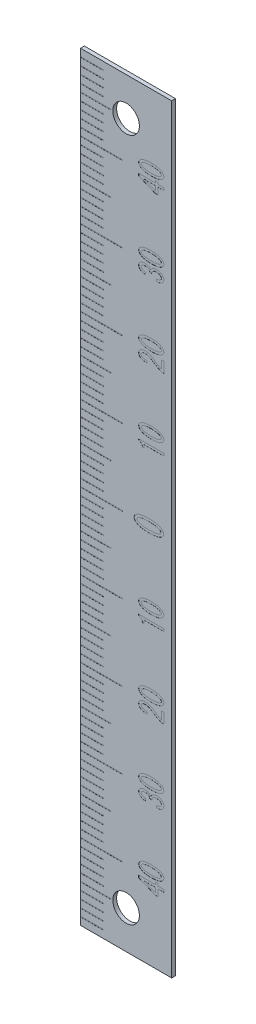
SolidWorks part; units mm, degrees
ref_plane "Front" through (0, 0, 0) normal (0, 0, 1) x (1, 0, 0)
ref_plane "Top" through (0, 0, 0) normal (0, 1, 0) x (1, 0, 0)
ref_plane "Right" through (0, 0, 0) normal (1, 0, 0) x (0, 0, -1)
sketch "Sketch1" plane through (0, 0, 0) normal (0, 0, 1) x (1, 0, 0)
  line L1 (0, 0) -> (0, 100)
  line L2 (0, 0) -> (12, 0)
  line L3 (12, 0) -> (12, 100)
  line L4 (0, 100) -> (12, 100)
  dimension "D1" = 100
  dimension "D2" = 12
extrude "Extrude1" add sketch "Sketch1" along normal blind 0.5
sketch "Sketch2" plane through (0, 0, 0.5) normal (0, 0, 1) x (1, 0, 0)
  line L0 (0, 100) -> (0, 0) construction
  line L1 (0, 0) -> (12, 0) construction
  line L2 (12, 100) -> (0, 100) construction
  circle A0 centre (6, 5) radius 1.75
  circle A1 centre (6, 95) radius 1.75
  dimension "D1" = 6
  dimension "D2" = 6
  dimension "D3" = 5
  dimension "D4" = 5
  dimension "D5" = 3.5
  dimension "D6" = 3.5
extrude "Extrude2" cut sketch "Sketch2" against normal through all
sketch "Sketch3" plane through (0, 0, 0.5) normal (0, 0, 1) x (1, 0, 0)
  line L0 (12, 100) -> (0, 100) construction
  line L1 (7.5, 88.25) -> (11, 88.25) construction
  line L2 (7.5, 88.25) -> (7.5, 91.75) construction
  line L3 (7.5, 91.75) -> (11, 91.75) construction
  line L4 (11, 88.25) -> (11, 91.75) construction
  line L6 (11, 78.25) -> (11, 81.75) construction
  line L7 (11, 68.25) -> (11, 71.75) construction
  line L8 (11, 58.25) -> (11, 61.75) construction
  line L9 (11, 49.125) -> (11, 52.625) construction
  line L10 (11, 38.25) -> (11, 41.75) construction
  line L11 (11, 28.25) -> (11, 31.75) construction
  line L12 (11, 18.25) -> (11, 21.75) construction
  line L13 (11, 8.25) -> (11, 11.75) construction
  line L14 (8.2751, 50) -> (-8.2751, 50) construction
  line L15 (8.2751, 40) -> (-8.2751, 40) construction
  line L16 (12, 0) -> (12, 100) construction
  line L17 (8.2751, 30) -> (-8.2751, 30) construction
  line L18 (8.2751, 20) -> (-8.2751, 20) construction
  line L19 (8.2751, 10) -> (-8.2751, 10) construction
  line L20 (8.2751, 60) -> (-8.2751, 60) construction
  line L21 (8.2751, 70) -> (-8.2751, 70) construction
  line L22 (8.2751, 80) -> (-8.2751, 80) construction
  line L23 (8.2751, 90) -> (-8.2751, 90) construction
  text T0 "40" font "ＭＳ ゴシック" height in points 11
  text T1 "30" font "ＭＳ ゴシック" height in points 11
  text T2 "20" font "ＭＳ ゴシック" height in points 11
  text T3 "10" font "ＭＳ ゴシック" height in points 11
  text T4 "0" font "ＭＳ ゴシック" height in points 13
  text T5 "10  " font "ＭＳ ゴシック" height in points 11
  text T6 "20" font "ＭＳ ゴシック" height in points 11
  text T7 "30" font "ＭＳ ゴシック" height in points 11
  text T8 "40" font "ＭＳ ゴシック" height in points 11
  point P4 (11, 90)
  point P36 (0, 50)
  dimension "D1" = 3.5
  dimension "D2" = 10
  dimension "D3" = 1
  dimension "D4" = 3.5
  dimension "D7" = 5
  dimension "D9" = 0.875
  dimension "D6" = 1
  dimension "D5" = 4
  dimension "D8" = 5
extrude "Extrude3" cut sketch "Sketch3" against normal blind 0.01
sketch "Sketch4" plane through (0, 0, 0.5) normal (0, 0, 1) x (1, 0, 0)
  line L5 (12, 100) -> (0, 100) construction
  line L406 (6, 100) -> (6, 0) construction
  line L407 (0, 0) -> (12, 0) construction
  line L408 (3, 1.05) -> (3, 0.95)
  line L409 (0, 0.95) -> (3, 0.95)
  line L410 (0, 1.05) -> (3, 1.05)
  line L411 (0, 1.05) -> (0, 0.95)
  line L412 (3, 2.05) -> (3, 1.95)
  line L413 (0, 1.95) -> (3, 1.95)
  line L414 (0, 2.05) -> (3, 2.05)
  line L415 (0, 2.05) -> (0, 1.95)
  line L416 (3, 3.05) -> (3, 2.95)
  line L417 (0, 2.95) -> (3, 2.95)
  line L418 (0, 3.05) -> (3, 3.05)
  line L419 (0, 3.05) -> (0, 2.95)
  line L420 (3, 4.05) -> (3, 3.95)
  line L421 (0, 3.95) -> (3, 3.95)
  line L422 (0, 4.05) -> (3, 4.05)
  line L423 (0, 4.05) -> (0, 3.95)
  line L424 (3, 6.05) -> (3, 5.95)
  line L425 (0, 5.95) -> (3, 5.95)
  line L426 (0, 6.05) -> (3, 6.05)
  line L427 (0, 6.05) -> (0, 5.95)
  line L428 (3, 7.05) -> (3, 6.95)
  line L429 (0, 6.95) -> (3, 6.95)
  line L430 (0, 7.05) -> (3, 7.05)
  line L431 (0, 7.05) -> (0, 6.95)
  line L432 (3, 8.05) -> (3, 7.95)
  line L433 (0, 7.95) -> (3, 7.95)
  line L434 (0, 8.05) -> (3, 8.05)
  line L435 (3, 9.05) -> (3, 8.95)
  line L436 (0, 8.95) -> (3, 8.95)
  line L437 (0, 9.05) -> (0, 8.95)
  line L438 (0, 9.05) -> (3, 9.05)
  line L439 (4, 4.95) -> (4, 5.05)
  line L440 (0, 5.05) -> (4, 5.05)
  line L441 (0, 4.95) -> (0, 5.05)
  line L442 (0, 4.95) -> (4, 4.95)
  line L443 (0, 8.05) -> (0, 7.95)
  line L444 (0, 9.95) -> (0, 10.05)
  line L445 (5.5, 9.95) -> (0, 9.95)
  line L446 (5.5, 10.05) -> (5.5, 9.95)
  line L447 (0, 10.05) -> (5.5, 10.05)
  line L448 (3, 11.05) -> (3, 10.95)
  line L449 (0, 10.95) -> (3, 10.95)
  line L450 (0, 11.05) -> (3, 11.05)
  line L451 (0, 11.05) -> (0, 10.95)
  line L452 (3, 12.05) -> (3, 11.95)
  line L453 (0, 11.95) -> (3, 11.95)
  line L454 (0, 12.05) -> (3, 12.05)
  line L455 (0, 12.05) -> (0, 11.95)
  line L456 (3, 13.05) -> (3, 12.95)
  line L457 (0, 12.95) -> (3, 12.95)
  line L458 (0, 13.05) -> (3, 13.05)
  line L459 (0, 13.05) -> (0, 12.95)
  line L460 (3, 14.05) -> (3, 13.95)
  line L461 (0, 13.95) -> (3, 13.95)
  line L462 (0, 14.05) -> (3, 14.05)
  line L463 (0, 14.05) -> (0, 13.95)
  line L464 (3, 16.05) -> (3, 15.95)
  line L465 (0, 15.95) -> (3, 15.95)
  line L466 (0, 16.05) -> (3, 16.05)
  line L467 (0, 16.05) -> (0, 15.95)
  line L468 (3, 17.05) -> (3, 16.95)
  line L469 (0, 16.95) -> (3, 16.95)
  line L470 (0, 17.05) -> (3, 17.05)
  line L471 (0, 17.05) -> (0, 16.95)
  line L472 (3, 18.05) -> (3, 17.95)
  line L473 (0, 17.95) -> (3, 17.95)
  line L474 (0, 18.05) -> (3, 18.05)
  line L475 (3, 19.05) -> (3, 18.95)
  line L476 (0, 18.95) -> (3, 18.95)
  line L477 (0, 19.05) -> (0, 18.95)
  line L478 (0, 19.05) -> (3, 19.05)
  line L479 (4, 14.95) -> (4, 15.05)
  line L480 (0, 15.05) -> (4, 15.05)
  line L481 (0, 14.95) -> (0, 15.05)
  line L482 (0, 14.95) -> (4, 14.95)
  line L483 (0, 18.05) -> (0, 17.95)
  line L484 (0, 19.95) -> (0, 20.05)
  line L485 (5.5, 19.95) -> (0, 19.95)
  line L486 (5.5, 20.05) -> (5.5, 19.95)
  line L487 (0, 20.05) -> (5.5, 20.05)
  line L488 (3, 21.05) -> (3, 20.95)
  line L489 (0, 20.95) -> (3, 20.95)
  line L490 (0, 21.05) -> (3, 21.05)
  line L491 (0, 21.05) -> (0, 20.95)
  line L492 (3, 22.05) -> (3, 21.95)
  line L493 (0, 21.95) -> (3, 21.95)
  line L494 (0, 22.05) -> (3, 22.05)
  line L495 (0, 22.05) -> (0, 21.95)
  line L496 (3, 23.05) -> (3, 22.95)
  line L497 (0, 22.95) -> (3, 22.95)
  line L498 (0, 23.05) -> (3, 23.05)
  line L499 (0, 23.05) -> (0, 22.95)
  line L500 (3, 24.05) -> (3, 23.95)
  line L501 (0, 23.95) -> (3, 23.95)
  line L502 (0, 24.05) -> (3, 24.05)
  line L503 (0, 24.05) -> (0, 23.95)
  line L504 (3, 26.05) -> (3, 25.95)
  line L505 (0, 25.95) -> (3, 25.95)
  line L506 (0, 26.05) -> (3, 26.05)
  line L507 (0, 26.05) -> (0, 25.95)
  line L508 (3, 27.05) -> (3, 26.95)
  line L509 (0, 26.95) -> (3, 26.95)
  line L510 (0, 27.05) -> (3, 27.05)
  line L511 (0, 27.05) -> (0, 26.95)
  line L512 (3, 28.05) -> (3, 27.95)
  line L513 (0, 27.95) -> (3, 27.95)
  line L514 (0, 28.05) -> (3, 28.05)
  line L515 (3, 29.05) -> (3, 28.95)
  line L516 (0, 28.95) -> (3, 28.95)
  line L517 (0, 29.05) -> (0, 28.95)
  line L518 (0, 29.05) -> (3, 29.05)
  line L519 (4, 24.95) -> (4, 25.05)
  line L520 (0, 25.05) -> (4, 25.05)
  line L521 (0, 24.95) -> (0, 25.05)
  line L522 (0, 24.95) -> (4, 24.95)
  line L523 (0, 28.05) -> (0, 27.95)
  line L524 (0, 29.95) -> (0, 30.05)
  line L525 (5.5, 29.95) -> (0, 29.95)
  line L526 (5.5, 30.05) -> (5.5, 29.95)
  line L527 (0, 30.05) -> (5.5, 30.05)
  line L528 (3, 31.05) -> (3, 30.95)
  line L529 (0, 30.95) -> (3, 30.95)
  line L530 (0, 31.05) -> (3, 31.05)
  line L531 (0, 31.05) -> (0, 30.95)
  line L532 (3, 32.05) -> (3, 31.95)
  line L533 (0, 31.95) -> (3, 31.95)
  line L534 (0, 32.05) -> (3, 32.05)
  line L535 (0, 32.05) -> (0, 31.95)
  line L536 (3, 33.05) -> (3, 32.95)
  line L537 (0, 32.95) -> (3, 32.95)
  line L538 (0, 33.05) -> (3, 33.05)
  line L539 (0, 33.05) -> (0, 32.95)
  line L540 (3, 34.05) -> (3, 33.95)
  line L541 (0, 33.95) -> (3, 33.95)
  line L542 (0, 34.05) -> (3, 34.05)
  line L543 (0, 34.05) -> (0, 33.95)
  line L544 (3, 36.05) -> (3, 35.95)
  line L545 (0, 35.95) -> (3, 35.95)
  line L546 (0, 36.05) -> (3, 36.05)
  line L547 (0, 36.05) -> (0, 35.95)
  line L548 (3, 37.05) -> (3, 36.95)
  line L549 (0, 36.95) -> (3, 36.95)
  line L550 (0, 37.05) -> (3, 37.05)
  line L551 (0, 37.05) -> (0, 36.95)
  line L552 (3, 38.05) -> (3, 37.95)
  line L553 (0, 37.95) -> (3, 37.95)
  line L554 (0, 38.05) -> (3, 38.05)
  line L555 (3, 39.05) -> (3, 38.95)
  line L556 (0, 38.95) -> (3, 38.95)
  line L557 (0, 39.05) -> (0, 38.95)
  line L558 (0, 39.05) -> (3, 39.05)
  line L559 (4, 34.95) -> (4, 35.05)
  line L560 (0, 35.05) -> (4, 35.05)
  line L561 (0, 34.95) -> (0, 35.05)
  line L562 (0, 34.95) -> (4, 34.95)
  line L563 (0, 38.05) -> (0, 37.95)
  line L564 (0, 39.95) -> (0, 40.05)
  line L565 (5.5, 39.95) -> (0, 39.95)
  line L566 (5.5, 40.05) -> (5.5, 39.95)
  line L567 (0, 40.05) -> (5.5, 40.05)
  line L568 (3, 41.05) -> (3, 40.95)
  line L569 (0, 40.95) -> (3, 40.95)
  line L570 (0, 41.05) -> (3, 41.05)
  line L571 (0, 41.05) -> (0, 40.95)
  line L572 (3, 42.05) -> (3, 41.95)
  line L573 (0, 41.95) -> (3, 41.95)
  line L574 (0, 42.05) -> (3, 42.05)
  line L575 (0, 42.05) -> (0, 41.95)
  line L576 (3, 43.05) -> (3, 42.95)
  line L577 (0, 42.95) -> (3, 42.95)
  line L578 (0, 43.05) -> (3, 43.05)
  line L579 (0, 43.05) -> (0, 42.95)
  line L580 (3, 44.05) -> (3, 43.95)
  line L581 (0, 43.95) -> (3, 43.95)
  line L582 (0, 44.05) -> (3, 44.05)
  line L583 (0, 44.05) -> (0, 43.95)
  line L584 (3, 46.05) -> (3, 45.95)
  line L585 (0, 45.95) -> (3, 45.95)
  line L586 (0, 46.05) -> (3, 46.05)
  line L587 (0, 46.05) -> (0, 45.95)
  line L588 (3, 47.05) -> (3, 46.95)
  line L589 (0, 46.95) -> (3, 46.95)
  line L590 (0, 47.05) -> (3, 47.05)
  line L591 (0, 47.05) -> (0, 46.95)
  line L592 (3, 48.05) -> (3, 47.95)
  line L593 (0, 47.95) -> (3, 47.95)
  line L594 (0, 48.05) -> (3, 48.05)
  line L595 (3, 49.05) -> (3, 48.95)
  line L596 (0, 48.95) -> (3, 48.95)
  line L597 (0, 49.05) -> (0, 48.95)
  line L598 (0, 49.05) -> (3, 49.05)
  line L599 (4, 44.95) -> (4, 45.05)
  line L600 (0, 45.05) -> (4, 45.05)
  line L601 (0, 44.95) -> (0, 45.05)
  line L602 (0, 44.95) -> (4, 44.95)
  line L603 (0, 48.05) -> (0, 47.95)
  line L604 (3, 51.05) -> (3, 50.95)
  line L605 (0, 50.95) -> (3, 50.95)
  line L606 (0, 51.05) -> (3, 51.05)
  line L607 (0, 51.05) -> (0, 50.95)
  line L608 (3, 52.05) -> (3, 51.95)
  line L609 (0, 51.95) -> (3, 51.95)
  line L610 (0, 52.05) -> (3, 52.05)
  line L611 (0, 52.05) -> (0, 51.95)
  line L612 (3, 53.05) -> (3, 52.95)
  line L613 (0, 52.95) -> (3, 52.95)
  line L614 (0, 53.05) -> (3, 53.05)
  line L615 (0, 53.05) -> (0, 52.95)
  line L616 (3, 54.05) -> (3, 53.95)
  line L617 (0, 53.95) -> (3, 53.95)
  line L618 (0, 54.05) -> (3, 54.05)
  line L619 (0, 54.05) -> (0, 53.95)
  line L620 (3, 56.05) -> (3, 55.95)
  line L621 (0, 55.95) -> (3, 55.95)
  line L622 (0, 56.05) -> (3, 56.05)
  line L623 (0, 56.05) -> (0, 55.95)
  line L624 (3, 57.05) -> (3, 56.95)
  line L625 (0, 56.95) -> (3, 56.95)
  line L626 (0, 57.05) -> (3, 57.05)
  line L627 (0, 57.05) -> (0, 56.95)
  line L628 (3, 58.05) -> (3, 57.95)
  line L629 (0, 57.95) -> (3, 57.95)
  line L630 (0, 58.05) -> (3, 58.05)
  line L631 (3, 59.05) -> (3, 58.95)
  line L632 (0, 58.95) -> (3, 58.95)
  line L633 (0, 59.05) -> (0, 58.95)
  line L634 (0, 59.05) -> (3, 59.05)
  line L635 (4, 54.95) -> (4, 55.05)
  line L636 (0, 55.05) -> (4, 55.05)
  line L637 (0, 54.95) -> (0, 55.05)
  line L638 (0, 54.95) -> (4, 54.95)
  line L639 (0, 58.05) -> (0, 57.95)
  line L640 (0, 49.95) -> (0, 50.05)
  line L641 (5.5, 49.95) -> (0, 49.95)
  line L642 (5.5, 50.05) -> (5.5, 49.95)
  line L643 (0, 50.05) -> (5.5, 50.05)
  line L644 (3, 61.05) -> (3, 60.95)
  line L645 (0, 60.95) -> (3, 60.95)
  line L646 (0, 61.05) -> (3, 61.05)
  line L647 (0, 61.05) -> (0, 60.95)
  line L648 (3, 62.05) -> (3, 61.95)
  line L649 (0, 61.95) -> (3, 61.95)
  line L650 (0, 62.05) -> (3, 62.05)
  line L651 (0, 62.05) -> (0, 61.95)
  line L652 (3, 63.05) -> (3, 62.95)
  line L653 (0, 62.95) -> (3, 62.95)
  line L654 (0, 63.05) -> (3, 63.05)
  line L655 (0, 63.05) -> (0, 62.95)
  line L656 (3, 64.05) -> (3, 63.95)
  line L657 (0, 63.95) -> (3, 63.95)
  line L658 (0, 64.05) -> (3, 64.05)
  line L659 (0, 64.05) -> (0, 63.95)
  line L660 (3, 66.05) -> (3, 65.95)
  line L661 (0, 65.95) -> (3, 65.95)
  line L662 (0, 66.05) -> (3, 66.05)
  line L663 (0, 66.05) -> (0, 65.95)
  line L664 (3, 67.05) -> (3, 66.95)
  line L665 (0, 66.95) -> (3, 66.95)
  line L666 (0, 67.05) -> (3, 67.05)
  line L667 (0, 67.05) -> (0, 66.95)
  line L668 (3, 68.05) -> (3, 67.95)
  line L669 (0, 67.95) -> (3, 67.95)
  line L670 (0, 68.05) -> (3, 68.05)
  line L671 (3, 69.05) -> (3, 68.95)
  line L672 (0, 68.95) -> (3, 68.95)
  line L673 (0, 69.05) -> (0, 68.95)
  line L674 (0, 69.05) -> (3, 69.05)
  line L675 (4, 64.95) -> (4, 65.05)
  line L676 (0, 65.05) -> (4, 65.05)
  line L677 (0, 64.95) -> (0, 65.05)
  line L678 (0, 64.95) -> (4, 64.95)
  line L679 (0, 68.05) -> (0, 67.95)
  line L680 (0, 59.95) -> (0, 60.05)
  line L681 (5.5, 59.95) -> (0, 59.95)
  line L682 (5.5, 60.05) -> (5.5, 59.95)
  line L683 (0, 60.05) -> (5.5, 60.05)
  line L684 (3, 71.05) -> (3, 70.95)
  line L685 (0, 70.95) -> (3, 70.95)
  line L686 (0, 71.05) -> (3, 71.05)
  line L687 (0, 71.05) -> (0, 70.95)
  line L688 (3, 72.05) -> (3, 71.95)
  line L689 (0, 71.95) -> (3, 71.95)
  line L690 (0, 72.05) -> (3, 72.05)
  line L691 (0, 72.05) -> (0, 71.95)
  line L692 (3, 73.05) -> (3, 72.95)
  line L693 (0, 72.95) -> (3, 72.95)
  line L694 (0, 73.05) -> (3, 73.05)
  line L695 (0, 73.05) -> (0, 72.95)
  line L696 (3, 74.05) -> (3, 73.95)
  line L697 (0, 73.95) -> (3, 73.95)
  line L698 (0, 74.05) -> (3, 74.05)
  line L699 (0, 74.05) -> (0, 73.95)
  line L700 (3, 76.05) -> (3, 75.95)
  line L701 (0, 75.95) -> (3, 75.95)
  line L702 (0, 76.05) -> (3, 76.05)
  line L703 (0, 76.05) -> (0, 75.95)
  line L704 (3, 77.05) -> (3, 76.95)
  line L705 (0, 76.95) -> (3, 76.95)
  line L706 (0, 77.05) -> (3, 77.05)
  line L707 (0, 77.05) -> (0, 76.95)
  line L708 (3, 78.05) -> (3, 77.95)
  line L709 (0, 77.95) -> (3, 77.95)
  line L710 (0, 78.05) -> (3, 78.05)
  line L711 (3, 79.05) -> (3, 78.95)
  line L712 (0, 78.95) -> (3, 78.95)
  line L713 (0, 79.05) -> (0, 78.95)
  line L714 (0, 79.05) -> (3, 79.05)
  line L715 (4, 74.95) -> (4, 75.05)
  line L716 (0, 75.05) -> (4, 75.05)
  line L717 (0, 74.95) -> (0, 75.05)
  line L718 (0, 74.95) -> (4, 74.95)
  line L719 (0, 78.05) -> (0, 77.95)
  line L720 (0, 69.95) -> (0, 70.05)
  line L721 (5.5, 69.95) -> (0, 69.95)
  line L722 (5.5, 70.05) -> (5.5, 69.95)
  line L723 (0, 70.05) -> (5.5, 70.05)
  line L724 (3, 81.05) -> (3, 80.95)
  line L725 (0, 80.95) -> (3, 80.95)
  line L726 (0, 81.05) -> (3, 81.05)
  line L727 (0, 81.05) -> (0, 80.95)
  line L728 (3, 82.05) -> (3, 81.95)
  line L729 (0, 81.95) -> (3, 81.95)
  line L730 (0, 82.05) -> (3, 82.05)
  line L731 (0, 82.05) -> (0, 81.95)
  line L732 (3, 83.05) -> (3, 82.95)
  line L733 (0, 82.95) -> (3, 82.95)
  line L734 (0, 83.05) -> (3, 83.05)
  line L735 (0, 83.05) -> (0, 82.95)
  line L736 (3, 84.05) -> (3, 83.95)
  line L737 (0, 83.95) -> (3, 83.95)
  line L738 (0, 84.05) -> (3, 84.05)
  line L739 (0, 84.05) -> (0, 83.95)
  line L740 (3, 86.05) -> (3, 85.95)
  line L741 (0, 85.95) -> (3, 85.95)
  line L742 (0, 86.05) -> (3, 86.05)
  line L743 (0, 86.05) -> (0, 85.95)
  line L744 (3, 87.05) -> (3, 86.95)
  line L745 (0, 86.95) -> (3, 86.95)
  line L746 (0, 87.05) -> (3, 87.05)
  line L747 (0, 87.05) -> (0, 86.95)
  line L748 (3, 88.05) -> (3, 87.95)
  line L749 (0, 87.95) -> (3, 87.95)
  line L750 (0, 88.05) -> (3, 88.05)
  line L751 (3, 89.05) -> (3, 88.95)
  line L752 (0, 88.95) -> (3, 88.95)
  line L753 (0, 89.05) -> (0, 88.95)
  line L754 (0, 89.05) -> (3, 89.05)
  line L755 (4, 84.95) -> (4, 85.05)
  line L756 (0, 85.05) -> (4, 85.05)
  line L757 (0, 84.95) -> (0, 85.05)
  line L758 (0, 84.95) -> (4, 84.95)
  line L759 (0, 88.05) -> (0, 87.95)
  line L760 (3, 91.05) -> (3, 90.95)
  line L761 (0, 90.95) -> (3, 90.95)
  line L762 (0, 91.05) -> (3, 91.05)
  line L763 (0, 91.05) -> (0, 90.95)
  line L764 (3, 92.05) -> (3, 91.95)
  line L765 (0, 91.95) -> (3, 91.95)
  line L766 (0, 92.05) -> (3, 92.05)
  line L767 (0, 92.05) -> (0, 91.95)
  line L768 (3, 93.05) -> (3, 92.95)
  line L769 (0, 92.95) -> (3, 92.95)
  line L770 (0, 93.05) -> (3, 93.05)
  line L771 (0, 93.05) -> (0, 92.95)
  line L772 (3, 94.05) -> (3, 93.95)
  line L773 (0, 93.95) -> (3, 93.95)
  line L774 (0, 94.05) -> (3, 94.05)
  line L775 (0, 94.05) -> (0, 93.95)
  line L776 (0, 79.95) -> (0, 80.05)
  line L777 (5.5, 79.95) -> (0, 79.95)
  line L778 (5.5, 80.05) -> (5.5, 79.95)
  line L779 (0, 80.05) -> (5.5, 80.05)
  line L780 (3, 96.05) -> (3, 95.95)
  line L781 (0, 95.95) -> (3, 95.95)
  line L782 (0, 96.05) -> (3, 96.05)
  line L783 (0, 96.05) -> (0, 95.95)
  line L784 (3, 97.05) -> (3, 96.95)
  line L785 (0, 96.95) -> (3, 96.95)
  line L786 (0, 97.05) -> (3, 97.05)
  line L787 (0, 97.05) -> (0, 96.95)
  line L788 (3, 98.05) -> (3, 97.95)
  line L789 (0, 97.95) -> (3, 97.95)
  line L790 (0, 98.05) -> (3, 98.05)
  line L791 (3, 99.05) -> (3, 98.95)
  line L792 (0, 98.95) -> (3, 98.95)
  line L793 (0, 99.05) -> (0, 98.95)
  line L794 (0, 99.05) -> (3, 99.05)
  line L795 (4, 94.95) -> (4, 95.05)
  line L796 (0, 95.05) -> (4, 95.05)
  line L797 (0, 94.95) -> (0, 95.05)
  line L798 (0, 94.95) -> (4, 94.95)
  line L799 (0, 98.05) -> (0, 97.95)
  line L800 (0, 89.95) -> (0, 90.05)
  line L801 (5.5, 89.95) -> (0, 89.95)
  line L802 (5.5, 90.05) -> (5.5, 89.95)
  line L803 (0, 90.05) -> (5.5, 90.05)
extrude "Extrude4" cut sketch "Sketch4" against normal blind 0.01
move or copy body "Body-Move/Copy2" bodies to move or copy 105 copy no translate (-12, -50, 0)
